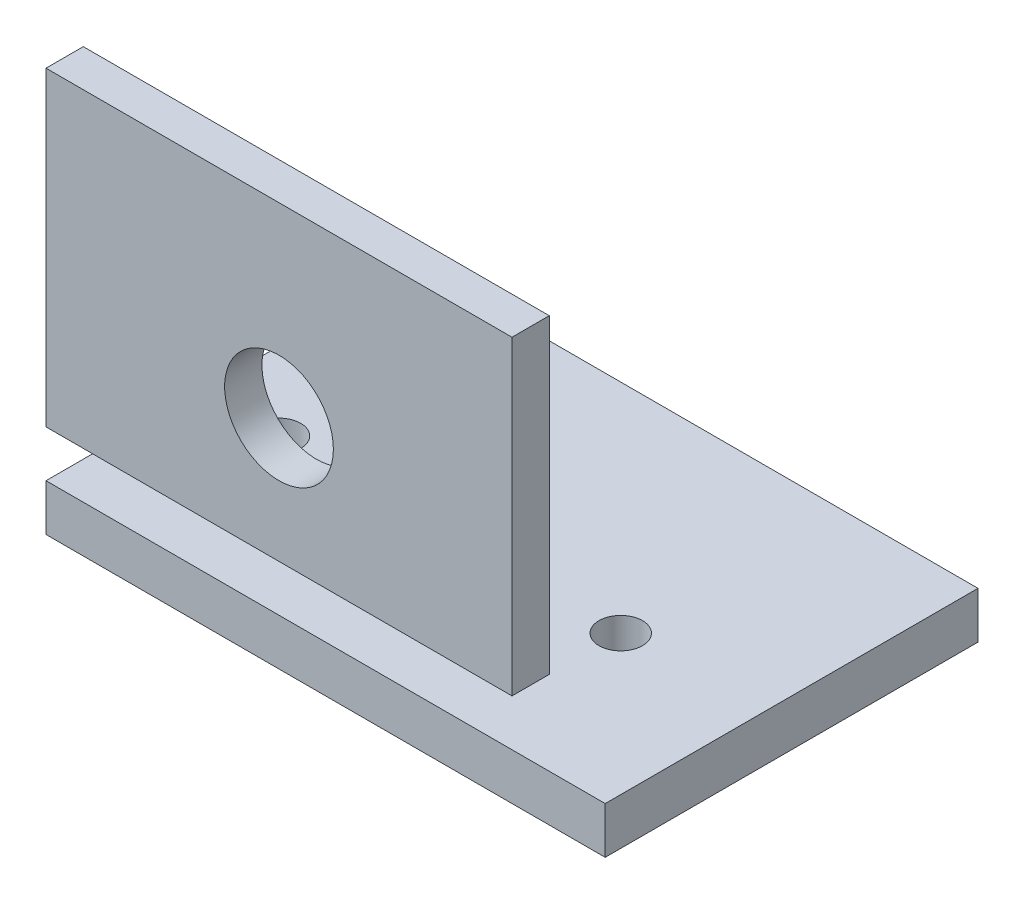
SolidWorks part; units mm, degrees
ref_plane "前视基准面" through (0, 0, 0) normal (0, 0, 1) x (1, 0, 0)
ref_plane "上视基准面" through (0, 0, 0) normal (0, 1, 0) x (1, 0, 0)
ref_plane "右视基准面" through (0, 0, 0) normal (1, 0, 0) x (0, 0, -1)
other "Configuration Table"
sketch "草图1" plane through (0, 0, 0) normal (0, 1, 0) x (1, 0, 0)
  line L1 (0, 0) -> (180, 0)
  line L2 (0, 0) -> (0, 120)
  line L3 (0, 120) -> (180, 120)
  line L4 (180, 0) -> (180, 120)
  dimension "D1" = 180
  dimension "D2" = 120
extrude "凸台-拉伸1" add sketch "草图1" against normal blind 15
sketch "草图2" plane through (0, 0, 0) normal (0, 1, 0) x (1, 0, 0)
  line L0 (25, 50) -> (135, 50) construction
  circle A0 centre (25, 50) radius 7
  circle A1 centre (135, 50) radius 7
  dimension "D2" = 14
  dimension "D3" = 14
  dimension "D1" = 110
extrude "切除-拉伸1" cut sketch "草图2" against normal blind 15
sketch "草图3" plane through (0, 0, 0) normal (0, 0, 1) x (1, 0, 0)
  line L1 (0, 15) -> (150, 15)
  line L2 (0, 15) -> (0, 115)
  line L3 (0, 115) -> (150, 115)
  line L4 (150, 15) -> (150, 115)
  dimension "D1" = 100
extrude "凸台-拉伸2" add sketch "草图3" against normal blind 12
sketch "草图4" plane through (0, 0, 0) normal (0, 0, 1) x (1, 0, 0)
  circle A0 centre (75, 55) radius 17.5
  dimension "D1" = 35
extrude "切除-拉伸2" cut sketch "草图4" against normal blind 12
